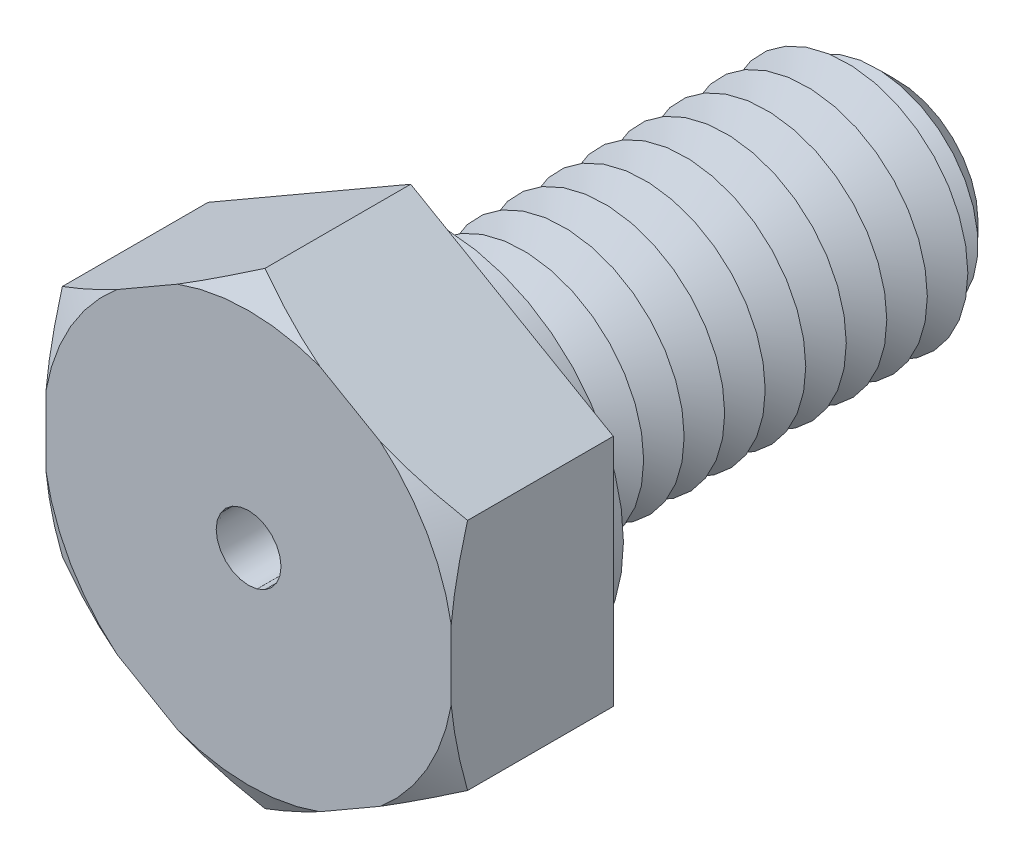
SolidWorks part; units mm, degrees
ref_plane "Front Plane" through (0, 0, 0) normal (0, 0, 1) x (1, 0, 0)
ref_plane "Top Plane" through (0, 0, 0) normal (0, 1, 0) x (1, 0, 0)
ref_plane "Right Plane" through (0, 0, 0) normal (1, 0, 0) x (0, 0, -1)
sketch "Sketch2" plane through (0, 0, 0) normal (0, 0, 1) x (1, 0, 0)
  line L1 (0, 5.7735) -> (-5, 2.8868)
  line L2 (-5, 2.8868) -> (-5, -2.8868)
  line L3 (-5, -2.8868) -> (0, -5.7735)
  line L4 (0, -5.7735) -> (5, -2.8868)
  line L5 (5, -2.8868) -> (5, 2.8868)
  line L6 (5, 2.8868) -> (0, 5.7735)
  circle A0 centre (0, 0) radius 5 construction
  dimension "D1" = 10
extrude "Boss-Extrude1" add sketch "Sketch2" along normal blind 4
sketch "Sketch3" plane through (0, 0, 0) normal (0, 0, -1) x (-1, 0, 0)
  circle A0 centre (0, 0) radius 3
  dimension "D1" = 6
extrude "Boss-Extrude2" add sketch "Sketch3" along normal blind 12
sketch "Sketch4" plane through (0, 0, 0) normal (0, 0, -1) x (-1, 0, 0)
  circle A0 centre (0, 0) radius 4.5
  dimension "D1" = 9
extrude "Boss-Extrude3" add sketch "Sketch4" along normal blind 0.75
sketch "Sketch5" plane through (0, 0, 0) normal (1, 0, 0) x (0, 0, -1)
  line L0 (-3.2117, 0) -> (6.3192, 0) construction
chamfer "Chamfer1" distance 1 angle 45 1 edges at (-3, 0, -12)
sketch "Sketch6" plane through (0, 0, 0) normal (1, 0, 0) x (0, 0, -1)
  line L0 (0.75, 3) -> (1.25, 2.134)
  line L1 (1.25, 2.134) -> (1.75, 3)
  line L2 (11, 3) -> (0.75, 3) construction
  line L3 (1.75, 3) -> (0.75, 3)
  dimension "D1" = 1
revolve "Cut-Revolve1" cut sketch "Sketch6" angle 360 about L0
pattern_linear "LPattern1" count 11 spacing 1 along (0, 0, -1) of "Cut-Revolve1"
sketch "Sketch7" plane through (0, 0, 0) normal (1, 0, 0) x (0, 0, -1)
  line L0 (-4, 5.7735) -> (-4, 5.0735)
  line L1 (-4, 2.8868) -> (-4, 5.7735) construction
  line L2 (-4, 5.0735) -> (-3.5959, 5.7735)
  line L3 (-4, 5.7735) -> (0, 5.7735) construction
  line L4 (-3.5959, 5.7735) -> (-4, 5.7735)
  dimension "D1" = 0.7
  dimension "D2" = 30
revolve "Cut-Revolve2" cut sketch "Sketch7" angle 360 about L0
sketch "Sketch8" plane through (0, 0, 4) normal (0, 0, 1) x (1, 0, 0)
  circle A0 centre (0, 0) radius 0.8
  dimension "D1" = 1.6
extrude "Cut-Extrude1" cut sketch "Sketch8" against normal up to surface (16 mm away)
